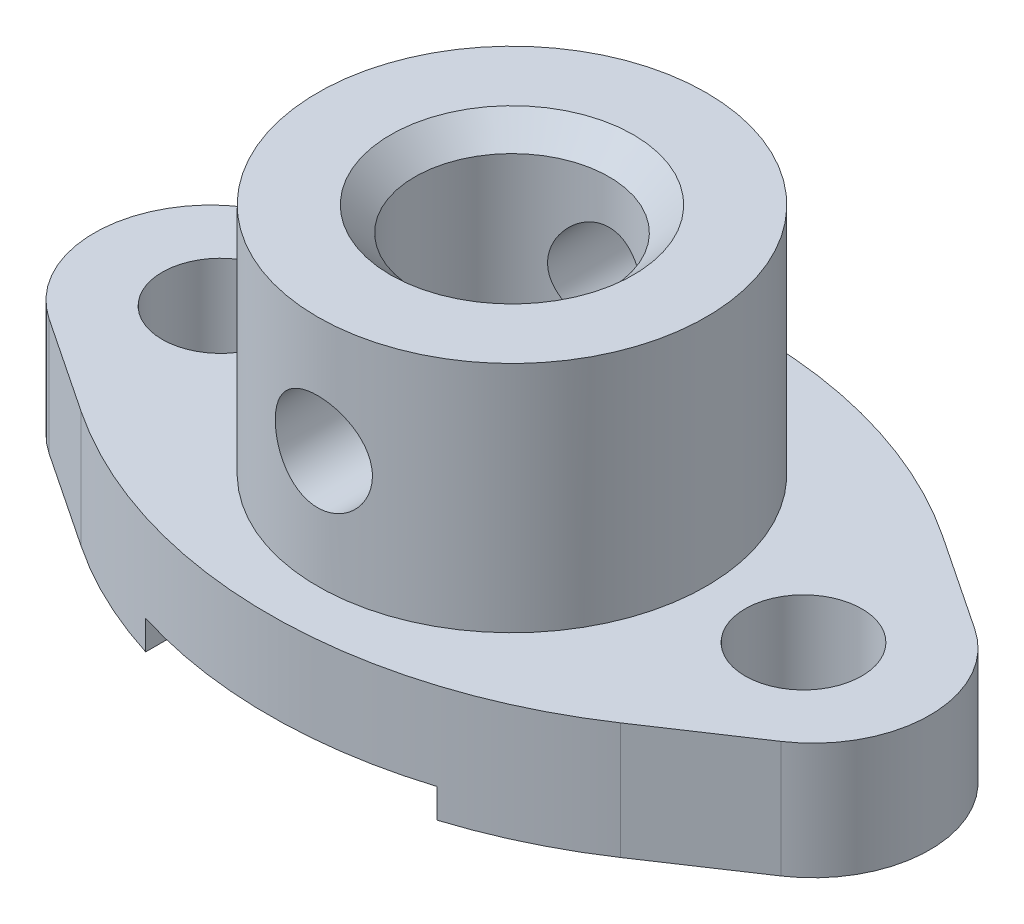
SolidWorks part; units mm, degrees
ref_plane "前视基准面" through (0, 0, 0) normal (0, 0, 1) x (1, 0, 0)
ref_plane "上视基准面" through (0, 0, 0) normal (0, 1, 0) x (1, 0, 0)
ref_plane "右视基准面" through (0, 0, 0) normal (1, 0, 0) x (0, 0, -1)
sketch "草图1" plane through (0, 0, 0) normal (0, 1, 0) x (1, 0, 0)
  line L0 (-110.9824, 66.3818) -> (-150.6358, 39.9316)
  line L1 (-150.6358, -39.9316) -> (-110.9824, -66.3818)
  line L2 (110.9824, -66.3818) -> (150.6358, -39.9316)
  line L3 (150.6358, 39.9316) -> (110.9824, 66.3818)
  line L4 (0, 33.3533) -> (0, -28.691) construction
  line L5 (-36.2224, 0) -> (21.8769, 0) construction
  line L6 (-148.4896, 0) -> (281.8347, 0) construction
  line L7 (0, 171.3856) -> (0, -175.5085) construction
  arc A0 (-150.6358, -39.9316) -> (-150.6358, 39.9316) centre (-124, 0) cw
  arc A1 (150.6358, -39.9316) -> (150.6358, 39.9316) centre (124, 0) ccw
  arc A2 (110.9824, 66.3818) -> (-110.9824, 66.3818) centre (0, -100) ccw
  arc A3 (110.9824, -66.3818) -> (-110.9824, -66.3818) centre (0, 100) cw
  circle A4 centre (120, 0) radius 24
  circle A5 centre (-120, 0) radius 24
  point P13 (-172, 0)
  point P16 (172, 0)
  point P21 (0, 100)
  point P24 (0, -100)
  dimension "D1" = 48
  dimension "D3" = 48
  dimension "D5" = 200
  dimension "D7" = 200
  dimension "D9" = 120
  dimension "D10" = 120
  dimension "D2" = 172
  dimension "D4" = 172
  dimension "D6" = 100
  dimension "D8" = 100
extrude "拉伸1" add sketch "草图1" along normal blind 48
sketch "草图2" plane through (0, 0, 0) normal (0, 0, 1) x (1, 0, 0)
  line L0 (0, -51.0649) -> (0, 46.0779) construction
  line L1 (-60, 12) -> (60, 12)
  line L2 (-60, 12) -> (-60, -23.0996)
  line L3 (-60, -23.0996) -> (60, -23.0996)
  line L4 (60, 12) -> (60, -23.0996)
  line L5 (-110.9824, 0) -> (110.9824, 0) construction
  dimension "D1" = 120
  dimension "D2" = 12
extrude "切除-拉伸1" cut sketch "草图2" against normal through all and the other way through all
sketch "草图3" plane through (0, 48, 0) normal (0, 1, 0) x (1, 0, 0)
  circle A0 centre (0, 0) radius 80
extrude "拉伸2" add sketch "草图3" along normal blind 96
sketch "草图4" plane through (0, 144, 0) normal (0, 1, 0) x (1, 0, 0)
  circle A0 centre (0, 0) radius 40
extrude "切除-拉伸2" cut sketch "草图4" against normal through all
chamfer "倒角1" distance 10 angle 45 1 edges at (0, 144, 40)
sketch "草图5" plane through (0, 0, 0) normal (0, 0, 1) x (1, 0, 0)
  circle A0 centre (0, 96) radius 20
  dimension "D2" = 40
  dimension "D1" = 96
extrude "切除-拉伸3" cut sketch "草图5" against normal through all and the other way through all
